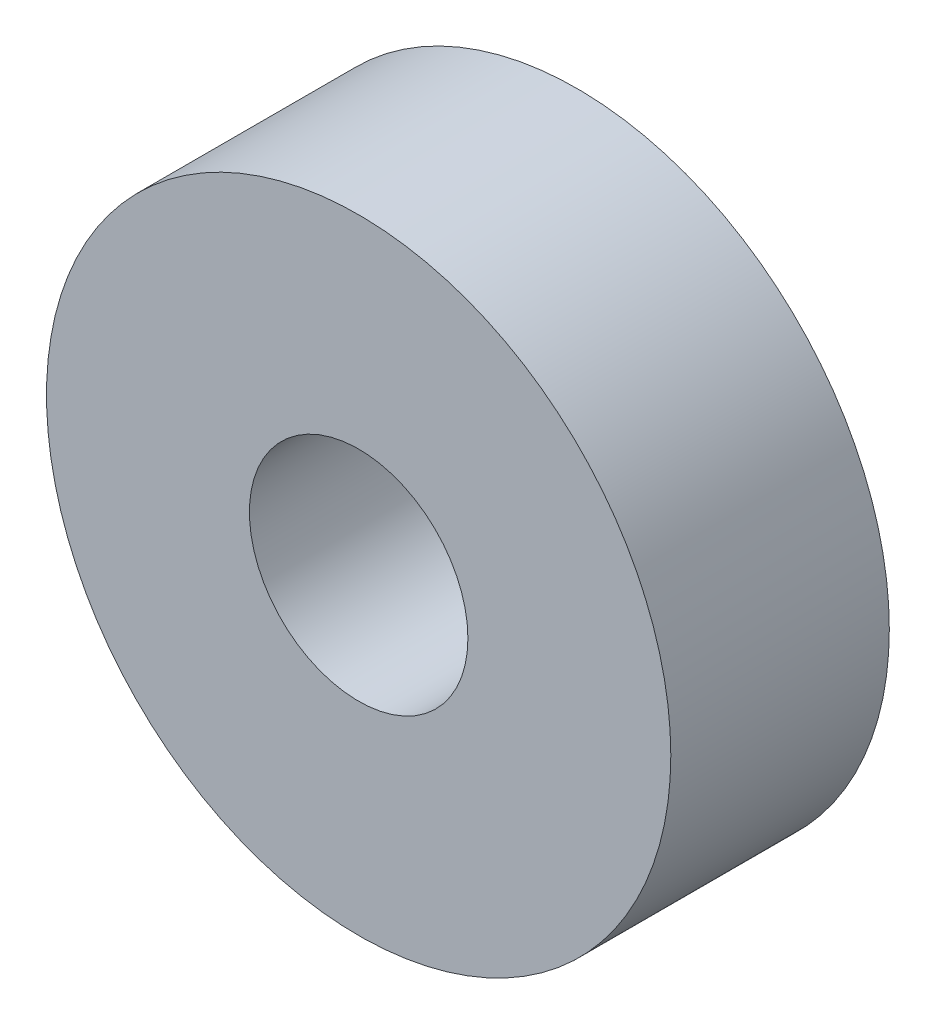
SolidWorks part; units mm, degrees
ref_plane "Спереди" through (0, 0, 0) normal (0, 0, 1) x (1, 0, 0)
ref_plane "Сверху" through (0, 0, 0) normal (0, 1, 0) x (1, 0, 0)
ref_plane "Справа" through (0, 0, 0) normal (1, 0, 0) x (0, 0, -1)
sketch "Эскиз1" plane through (0, 0, 0) normal (0, 0, 1) x (1, 0, 0)
  circle A0 centre (0, 0) radius 10
  circle A1 centre (0, 0) radius 3.5
  dimension "D1" = 20
  dimension "D2" = 7
extrude "Бобышка-Вытянуть1" add sketch "Эскиз1" along normal blind 7
move or copy body "Тело-Переместить/Копировать2" [suppressed] bodies to move or copy 103
move or copy body "Тело-Переместить/Копировать1" [suppressed] bodies to move or copy 103
